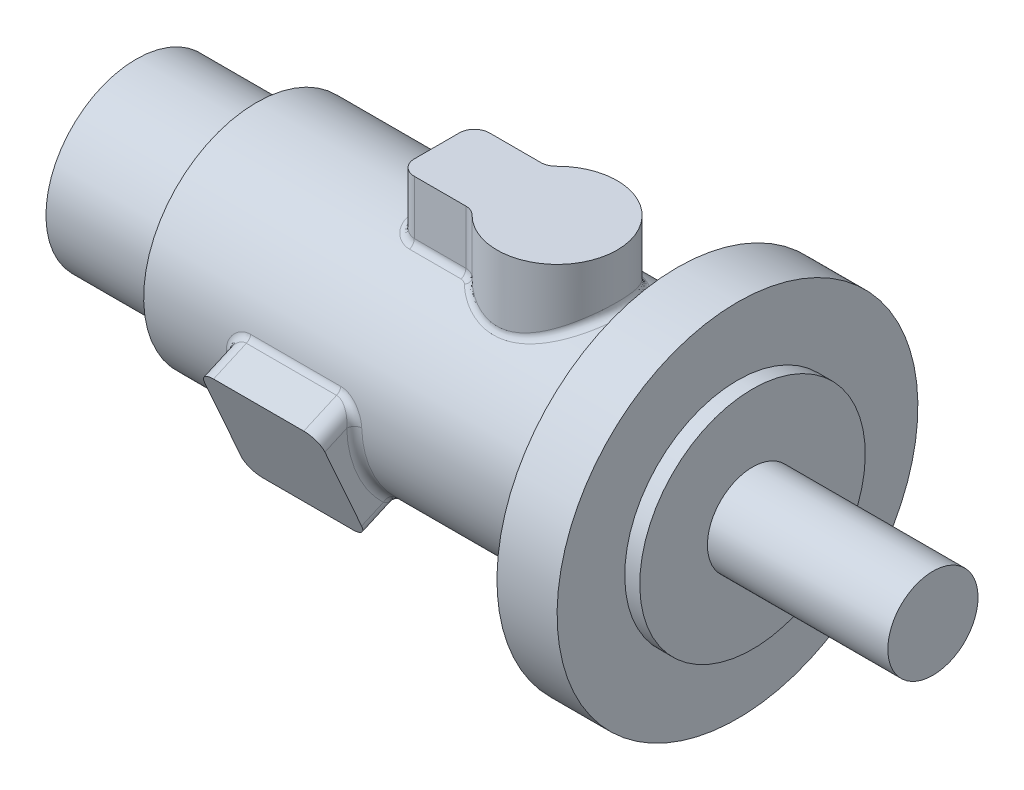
SolidWorks part; units mm, degrees
ref_plane "Front" through (0, 0, 0) normal (0, 0, 1) x (1, 0, 0)
ref_plane "Top" through (0, 0, 0) normal (0, 1, 0) x (1, 0, 0)
ref_plane "Right" through (0, 0, 0) normal (1, 0, 0) x (0, 0, -1)
sketch "Sketch1" plane through (0, 0, 0) normal (0, 0, 1) x (1, 0, 0)
  line L0 (42.975, 0) -> (28.575, 0) construction
  line L1 (0, 0) -> (0, 23.8125)
  line L2 (0, 23.8125) -> (-3.175, 23.8125)
  line L3 (-3.175, 23.8125) -> (-3.175, 38.1)
  line L4 (-3.175, 38.1) -> (-15.875, 38.1)
  line L5 (-15.875, 38.1) -> (-15.875, 23.8125)
  line L6 (-15.875, 23.8125) -> (-104.775, 23.8125)
  line L7 (-104.775, 23.8125) -> (-104.775, 19.05)
  line L8 (-104.775, 19.05) -> (-130.175, 19.05)
  line L9 (-130.175, 19.05) -> (-130.175, 0)
  line L10 (-130.175, 0) -> (0, 0)
  line L14 (0, 0) -> (-120.4051, 0) construction
  dimension "D1" = 47.625
  dimension "D2" = 3.175
  dimension "D3" = 12.7
  dimension "D4" = 76.2
  dimension "D5" = 127
  dimension "D6" = 25.4
  dimension "D7" = 38.1
revolve "case" add sketch "Sketch1" angle 360 about L0
sketch "Sketch2" plane through (0, 0, 0) normal (0, 1, 0) x (1, 0, 0)
  line L0 (0, 0) -> (-124.2367, 0) construction
  line L1 (-3.175, -38.1) -> (-3.175, 38.1) construction
  line L2 (-66.675, 7.9375) -> (-51.1889, 7.9375)
  line L3 (-66.675, -7.9375) -> (-51.1889, -7.9375)
  line L4 (-66.675, 7.9375) -> (-66.675, -7.9375)
  arc A1 (-51.1889, -7.9375) -> (-51.1889, 7.9375) centre (-41.275, 0) ccw
  dimension "D2" = 12.7
  dimension "D3" = 25.4
  dimension "D1" = 38.1
  dimension "D4" = 7.9375
extrude "upper" add sketch "Sketch2" along normal blind 34.925
ref_plane "angle front" through (0, 0, 0) normal (0, -0.4067, 0.9135) x (1, 0, 0)
sketch "Sketch3" plane through (0, 0, 0) normal (0, -0.4067, 0.9135) x (1, 0, 0)
  line L1 (-85.725, -12.7) -> (-60.325, -12.7)
  line L2 (-85.725, -12.7) -> (-85.725, 12.7)
  line L3 (-85.725, 12.7) -> (-60.325, 12.7)
  line L4 (-60.325, -12.7) -> (-60.325, 12.7)
  line L6 (-15.875, 38.1) -> (-15.875, -38.1) construction
  line L7 (-85.725, 0) -> (-60.325, 0) construction
  line L8 (42.975, 0) -> (28.575, 0) construction
  dimension "D1" = 44.45
  dimension "D2" = 25.4
  dimension "D3" = 25.4
extrude "side" add sketch "Sketch3" along normal blind 28.575
fillet "Fillet1" radius 3.175 8 edges at (-66.675, 28.6878, -7.9375) (-51.1889, 28.6878, -7.9375) (-51.1889, 28.6878, 7.9375) (-66.675, 28.6878, 7.9375) (-60.325, 1.6943, 27.4187) (-85.725, 1.6943, 27.4187) (-85.725, -21.5097, 17.0876) (-60.325, -21.5097, 17.0876)
fillet "Fillet2" radius 1.5875 16 edges at (-84.3216, -19.4359, 13.7579) (-73.025, -19.795, 13.2361) (-61.1589, -19.1035, 14.2159) (-60.325, -9.6854, 21.7538) (-85.725, -9.6854, 21.7538) (-61.7284, 2.7811, 23.6495) (-84.8911, 2.2182, 23.709) (-66.675, 23.8125, 0) (-65.9498, 22.8262, -6.7821) (-58.056, 22.4506, -7.9375) (-51.6109, 22.3927, -8.0995) (-28.7569, 23.716, -2.1418) (-65.4072, 22.6657, 7.3009) (-58.056, 22.4506, 7.9375) (-51.1647, 22.3241, 8.2866) (-73.025, 3.4091, 23.5672)
sketch "Sketch4" plane through (0, 0, 0) normal (1, 0, 0) x (0, 0, -1)
  circle A0 centre (0, 0) radius 9.525
  dimension "D1" = 19.05
extrude "shaft" add sketch "Sketch4" along normal blind 38.1
sketch "Sketch21" [suppressed] plane through (-41.0764, 34.925, -2.2283) normal (0, -1, 0) x (1, 0, 0)
  line L0 (0.4533, 5.3357) -> (-0.8506, -0.879) construction
  line L1 (3.175, 0) -> (-3.0397, 1.3039) construction
  circle A0 centre (-0.1986, 2.2283) radius 12.7 construction
  point P5 (-0.1986, 2.2283)
  dimension "D3" = 6.35
ref_plane "Plane1" [suppressed] through (-41.275, 34.925, 0) normal (-0.2053, 0, -0.9787) x (-0.9787, 0, 0.2053)
sketch "Port Sketch" [suppressed] plane through (-38.0278, 34.925, -0.6813) normal (0.2053, 0, 0.9787) x (-0.9787, 0, 0.2053)
  line L0 (3.3179, 0) -> (3.3179, 45.0293) construction
  line L1 (3.3179, 15.6756) -> (6.7723, 13.6)
  line L2 (6.7723, 13.6) -> (6.7723, 11.6)
  line L3 (6.7723, 11.6) -> (7.2867, 11.6)
  line L4 (7.2867, 11.6) -> (7.2867, 3.6542)
  line L5 (7.2867, 3.6542) -> (7.2409, 3.7)
  line L6 (7.2409, 3.7) -> (7.6445, 1.8012)
  line L7 (7.8929, 1.6) -> (11.8179, 1.6)
  line L8 (11.8179, 1.6) -> (11.8179, 0)
  line L10 (11.8179, 0) -> (3.3179, 0)
  line L11 (3.3179, 0) -> (3.3179, 15.6756)
  line L12 (-0.605, 3.7) -> (-1.0086, 1.8012) construction
  line L13 (-0.6508, 3.6542) -> (-0.605, 3.7) construction
  line L14 (3.3179, 15.6756) -> (-0.1365, 13.6) construction
  arc A0 (7.6445, 1.8012) -> (7.8929, 1.6) centre (7.8929, 1.854) ccw
  dimension "D1" = 0.254
  dimension "Countersink angle" = 118
  dimension "D3" = 45
  dimension "TapDrillDia" = 6.9088
  dimension "D5" = 9.15
  dimension "ThdMjr" = 7.9375
  dimension "SpotDia" = 17
  dimension "L3" = 1.6
  dimension "L1" = 2.1
  dimension "ThdDp" = 10
  dimension "TapDrillDp" = 12
  dimension "K" = 12
revolve "SAE Port" [suppressed] cut sketch "Port Sketch" angle 360 about L0
other "sae j1926-1 (circular face)<1>" [suppressed]
sketch "Sketch23" [suppressed] plane through (-26.6861, 38.2512, 48.3098) normal (0, 0.4067, -0.9135) x (-1, 0, 0)
  line L0 (43.1639, -54.5936) -> (49.5139, -54.5936) construction
  line L1 (46.3389, -51.4186) -> (46.3389, -57.7686) construction
  line L2 (33.6389, -45.0686) -> (33.6389, -64.1186) construction
  line L3 (55.8639, -41.8936) -> (36.8139, -41.8936) construction
  point P4 (46.3389, -54.5936)
  dimension "Locating dim1" = 12.7
  dimension "Locating dim2" = 12.7
  dimension "D3" = 6.35
ref_plane "Plane12" [suppressed] through (-73.025, -11.6225, 26.1046) normal (-1, 0, 0) x (0, 0, 1)
sketch "Port Sketch2" [suppressed] plane through (-73.025, -56.9704, 5.9144) normal (1, 0, 0) x (0, -0.9135, -0.4067)
  line L0 (-49.6395, 0) -> (-49.6395, 45.0293) construction
  line L1 (-49.6395, 18.5806) -> (-44.6789, 15.6)
  line L2 (-44.6789, 15.6) -> (-44.6789, 13.1)
  line L3 (-44.6789, 13.1) -> (-44.0832, 13.1)
  line L4 (-44.0832, 13.1) -> (-44.0832, 4.1104)
  line L5 (-44.0832, 4.1104) -> (-44.1728, 4.2)
  line L6 (-44.1728, 4.2) -> (-43.6629, 1.8012)
  line L7 (-43.4145, 1.6) -> (-39.1395, 1.6)
  line L8 (-39.1395, 1.6) -> (-39.1395, 0)
  line L10 (-39.1395, 0) -> (-49.6395, 0)
  line L11 (-49.6395, 0) -> (-49.6395, 18.5806)
  line L12 (-55.1061, 4.2) -> (-55.616, 1.8012) construction
  line L13 (-55.1957, 4.1104) -> (-55.1061, 4.2) construction
  line L14 (-49.6395, 18.5806) -> (-54.6001, 15.6) construction
  arc A0 (-43.6629, 1.8012) -> (-43.4145, 1.6) centre (-43.4145, 1.854) ccw
  dimension "D1" = 0.254
  dimension "Countersink angle" = 118
  dimension "D3" = 45
  dimension "TapDrillDia" = 9.9212
  dimension "D5" = 12.45
  dimension "ThdMjr" = 11.1125
  dimension "SpotDia" = 21
  dimension "L3" = 1.6
  dimension "L1" = 2.6
  dimension "ThdDp" = 11.5
  dimension "TapDrillDp" = 14
  dimension "K" = 12
revolve "SAE Port2" [suppressed] cut sketch "Port Sketch2" angle 360 about L0
other "sae j1926-1 (rectangular face)<1>" [suppressed]
sketch "Sketch25" [suppressed] plane through (38.1, 3.5936, 1.3228) normal (1, 0, 0) x (0, 0, -1)
  line L0 (1.3228, 5.9314) -> (1.3228, -3.5936) construction
  line L1 (1.3228, -3.5936) -> (1.3228, 5.9314) construction
  circle A0 centre (1.3228, -3.5936) radius 9.525 construction
  circle A2 centre (1.3228, -3.5936) radius 9.525
  dimension "Angle from vertical" = 360
ref_plane "Plane14" [suppressed] through (38.1, 9.525, 0) normal (0, -1, 0) x (-1, 0, 0)
sketch "Sketch31" [suppressed] plane through (38.1, 9.525, -0.6614) normal (0, -1, 0) x (1, 0, 0)
  line L0 (-6.35, 0.6614) -> (-25.4, 0.6614) construction
  line L1 (-6.35, 3.0427) -> (-25.4, 3.0427)
  line L2 (-6.35, -1.7198) -> (-25.4, -1.7198)
  arc A0 (-6.35, 3.0427) -> (-6.35, -1.7198) centre (-6.35, 0.6614) cw
  arc A1 (-25.4, 3.0427) -> (-25.4, -1.7198) centre (-25.4, 0.6614) ccw
  dimension "Keyway width" = 4.7625
  dimension "Distance from end face" = 6.35
  dimension "Length of slot" = 19.05
extrude "Cut-Extrude1" [suppressed] cut sketch "Sketch31" along normal blind 1.9177
other "rectangular keyseat<1>" [suppressed]
